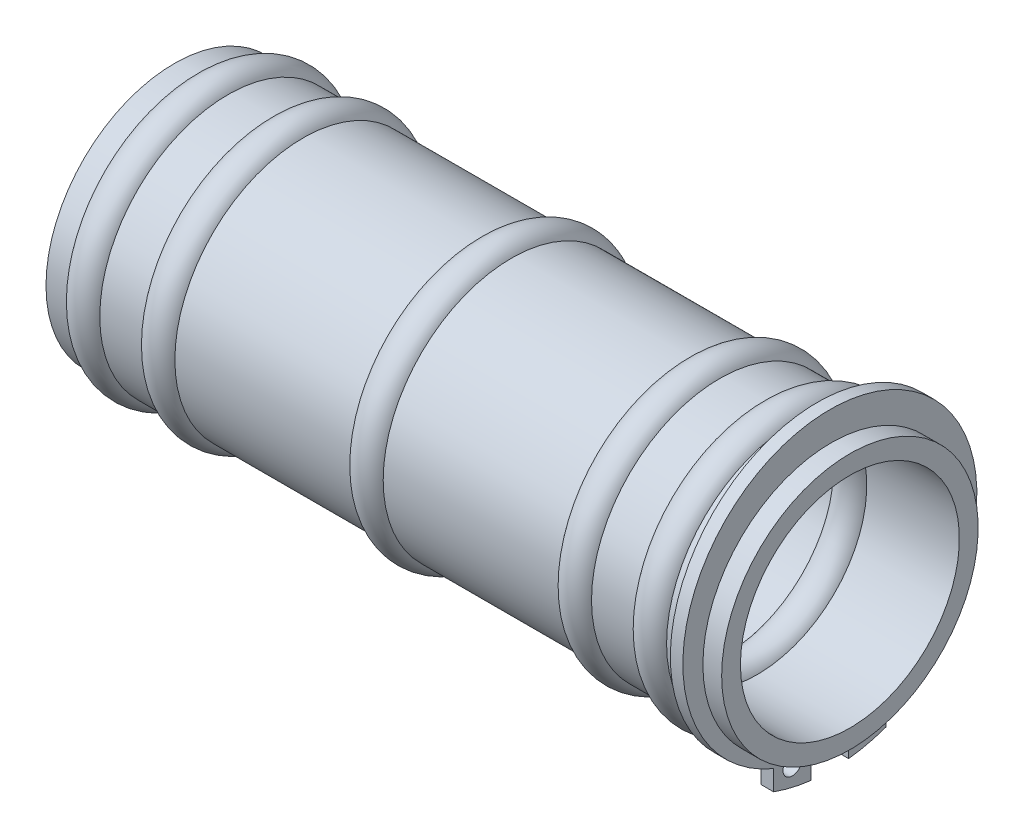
SolidWorks part; units mm, degrees
ref_plane "Plan de face" through (0, 0, 0) normal (0, 0, 1) x (1, 0, 0)
ref_plane "Plan de dessus" through (0, 0, 0) normal (0, 1, 0) x (1, 0, 0)
ref_plane "Plan de droite" through (0, 0, 0) normal (1, 0, 0) x (0, 0, -1)
sketch "Esquisse1" plane through (0, 0, 0) normal (0, 0, 1) x (1, 0, 0)
  line L0 (0, 8.75) -> (4.701, 8.75)
  line L1 (7.299, 8.75) -> (44.001, 8.75)
  line L2 (46.599, 8.75) -> (54, 8.75)
  line L3 (54, 8.75) -> (54, 10.25)
  line L4 (54, 10.25) -> (52.5, 10.25)
  line L5 (52.5, 10.25) -> (52.5, 9.5)
  line L6 (52.5, 9.5) -> (51.3, 9.5)
  line L7 (51.3, 9.5) -> (51.3, 10.25)
  line L8 (51.3, 10.25) -> (49.599, 10.25)
  line L9 (47.001, 10.25) -> (43.599, 10.25)
  line L10 (41.001, 10.25) -> (10.299, 10.25)
  line L11 (7.701, 10.25) -> (4.299, 10.25)
  line L12 (1.701, 10.25) -> (0, 10.25)
  line L13 (0, 10.25) -> (0, 8.75)
  line L14 (54, 0) -> (0, 0) construction
  arc A0 (4.701, 8.75) -> (7.299, 8.75) centre (6, 9.5) ccw
  arc A1 (44.001, 8.75) -> (46.599, 8.75) centre (45.3, 9.5) ccw
  arc A2 (49.599, 10.25) -> (47.001, 10.25) centre (48.3, 9.5) ccw
  arc A3 (43.599, 10.25) -> (41.001, 10.25) centre (42.3, 9.5) ccw
  arc A4 (10.299, 10.25) -> (7.701, 10.25) centre (9, 9.5) ccw
  arc A5 (4.299, 10.25) -> (1.701, 10.25) centre (3, 9.5) ccw
revolve "Révolution1" add sketch "Esquisse1" angle 360 about L14
sketch "Esquisse2" plane through (0, 0, 0) normal (0, 0, 1) x (1, 0, 0)
  line L0 (50, 0) -> (-50, 0) construction
  circle A0 centre (25.65, 9.5) radius 1.5
revolve "Révolution2" add sketch "Esquisse2" angle 360 about L0
ref_plane "Plan1" through (25.65, 0, 0) normal (1, 0, 0) x (0, 0, -1)
ref_plane "Plan2" through (51.3, 0, 0) normal (1, 0, 0) x (0, 0, -1)
ref_plane "Plan3" through (51.4, 0, 0) normal (1, 0, 0) x (0, 0, -1)
sketch "Esquisse3" plane through (51.4, 0, 0) normal (1, 0, 0) x (0, 0, -1)
  line L0 (-4.5, -10.1041) -> (-4.5, -11.7124)
  line L1 (-1.5, -12.4148) -> (-1.5, -9.1782)
  line L2 (1.5, -9.1782) -> (1.5, -12.4148)
  line L3 (4.5, -11.7124) -> (4.5, -10.1041)
  arc A0 (4.5, -10.1041) -> (-4.5, -10.1041) centre (0, 0.75) ccw
  arc A1 (-4.5, -11.7124) -> (-1.5, -12.4148) centre (0, 0.75) ccw
  arc A2 (-1.5, -9.1782) -> (1.5, -9.1782) centre (0, 0) cw
  arc A3 (1.5, -12.4148) -> (4.5, -11.7124) centre (0, 0.75) ccw
  circle A4 centre (3, -10.6106) radius 0.75
  circle A5 centre (-3, -10.6106) radius 0.75
extrude "Extrusion1" add sketch "Esquisse3" along normal blind 1
